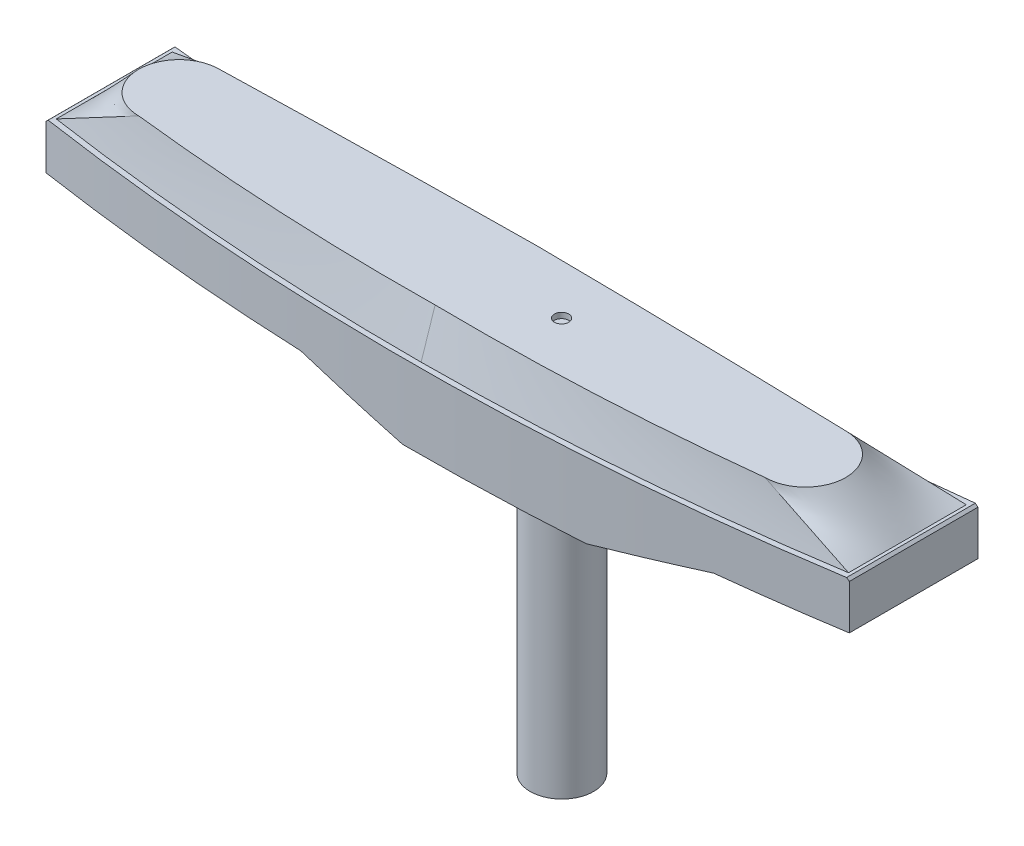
SolidWorks part; units mm, degrees
ref_plane "Plan1" through (0, 0, 0) normal (0, 0, 1) x (1, 0, 0)
ref_plane "Plan2" through (0, 0, 0) normal (0, 1, 0) x (1, 0, 0)
ref_plane "Plan3" through (0, 0, 0) normal (1, 0, 0) x (0, 0, -1)
mirrored part "patin-"
